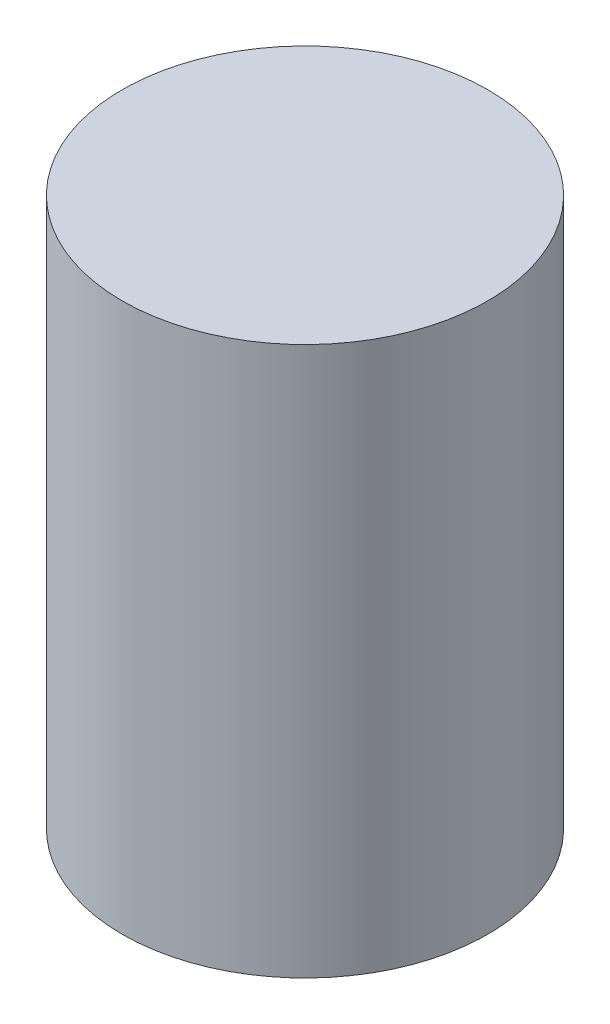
SolidWorks part; units mm, degrees
ref_plane "Front Plane" through (0, 0, 0) normal (0, 0, 1) x (1, 0, 0)
ref_plane "Top Plane" through (0, 0, 0) normal (0, 1, 0) x (1, 0, 0)
ref_plane "Right Plane" through (0, 0, 0) normal (1, 0, 0) x (0, 0, -1)
sketch "Sketch1" plane through (0, 0, 0) normal (0, 1, 0) x (1, 0, 0)
  circle A0 centre (0, 0) radius 6.35
  dimension "D1" = 12.7
extrude "Boss-Extrude1" add sketch "Sketch1" along normal blind 19.05
sketch "Sketch2" plane through (0, 0, 0) normal (0, -1, 0) x (1, 0, 0)
  circle A0 centre (0, 0) radius 3.175
  dimension "D1" = 6.35
extrude "Cut-Extrude1" cut sketch "Sketch2" against normal blind 15.875
sketch "Sketch3" plane through (0, 0, 0) normal (0, 0, 1) x (1, 0, 0)
  line L0 (-6.35, 0) -> (6.35, 0) construction
  line L1 (-6.35, 19.05) -> (-6.35, 0) construction
  circle A0 centre (0, 3.81) radius 1.27
  point P4 (0, 17.78)
  point P5 (0, 0)
  dimension "D2" = 2.54
  dimension "D1" = 3.81
  dimension "D3" = 6.35
extrude "Cut-Extrude2" cut sketch "Sketch3" against normal through all
